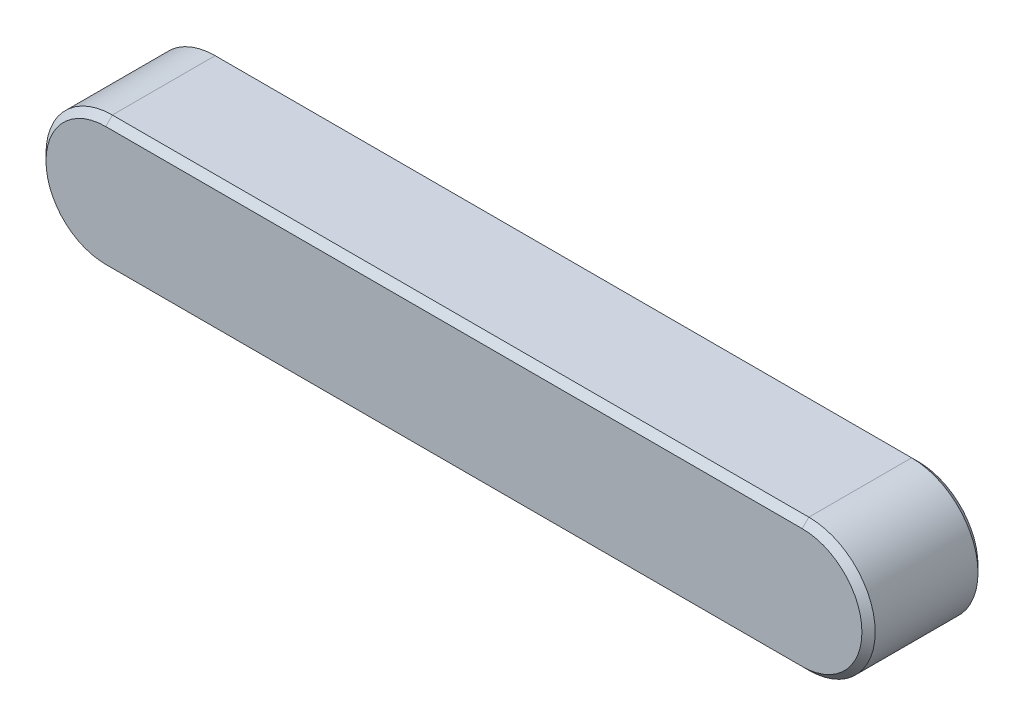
SolidWorks part; units mm, degrees
ref_plane "Front" through (0, 0, 0) normal (0, 0, 1) x (1, 0, 0)
ref_plane "Top" through (0, 0, 0) normal (0, 1, 0) x (1, 0, 0)
ref_plane "Right" through (0, 0, 0) normal (1, 0, 0) x (0, 0, -1)
sketch "body" plane through (0, 0, 0) normal (0, 0, 1) x (1, 0, 0)
  line L0 (42, 8) -> (-18, 8)
  line L1 (42, 0) -> (-18, 0)
  arc A0 (42, 8) -> (42, 0) centre (42, 4) cw
  arc A1 (0, 8) -> (0, 0) centre (0, 4) ccw
  circle A2 centre (0, 4) radius 4 construction
  point P7 (-4, 4)
  dimension "D1" = 60
  dimension "Width" = 8
  dimension "Length" = 50
extrude "Extrude1" add sketch "body" along normal blind 7 contours L0 A1 L1 A0
chamfer "Chamfer1" distance 0.4 8 edges at (46, 4, 0) (46, 4, 7) (21, 8, 7) (21, 0, 7) (21, 8, 0) (21, 0, 0) (-4, 4, 0) (-4, 4, 7)
equation "\"D1@body\" = \"Length@body\" + 10"
